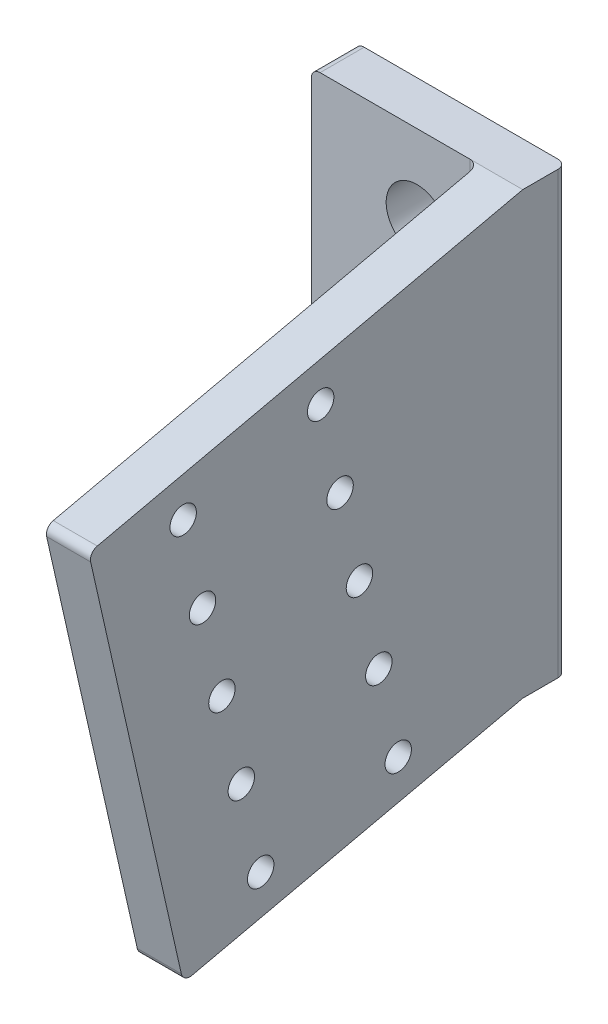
SolidWorks part; units mm, degrees
ref_plane "Front Plane" through (0, 0, 0) normal (0, 0, 1) x (1, 0, 0)
ref_plane "Top Plane" through (0, 0, 0) normal (0, 1, 0) x (1, 0, 0)
ref_plane "Right Plane" through (0, 0, 0) normal (1, 0, 0) x (0, 0, -1)
body saved out of another part "Stock-storage_space_to_ac_box_bracket_left-1"
fillet "Fillet1" radius 1 10 edges at (-95, 13.89, 54.2627) (-95, -33.69, 43.5322) (-92.5, 0, 0) (-116.5, -25, 2.5) (-116.5, 25, 2.5) (-109.5, 7.5, 2.5) (-109.5, -7.5, 2.5) (-99.5, -7.5, 2.5) (-99.5, 7.5, 2.5) (-97.5, 0, 5)
